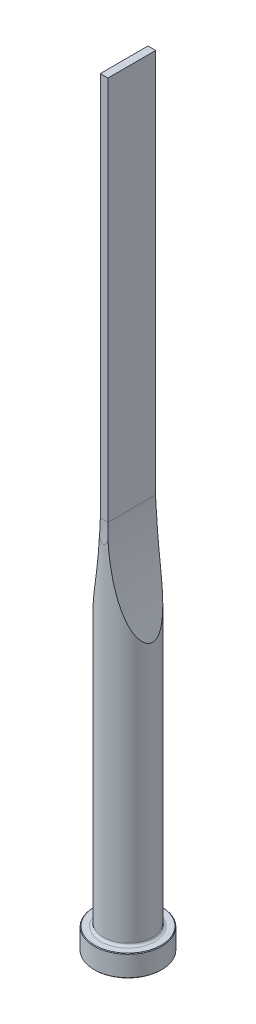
SolidWorks part; units mm, degrees
ref_plane "Front Plane" through (0, 0, 0) normal (0, 0, 1) x (1, 0, 0)
ref_plane "Top Plane" through (0, 0, 0) normal (0, 1, 0) x (1, 0, 0)
ref_plane "Right Plane" through (0, 0, 0) normal (1, 0, 0) x (0, 0, -1)
sketch "Sketch1" plane through (0, 0, 0) normal (0, 0, 1) x (1, 0, 0)
  line L0 (0, 0) -> (10.8, 0)
  line L1 (55, 0) -> (-55, 0) construction
  line L2 (11, 0.2) -> (11, 6.8)
  line L3 (10.8, 7) -> (8.8, 7)
  line L4 (8, 7.8) -> (8, 250)
  line L5 (0, 250) -> (8, 250)
  line L6 (11, 6.8) -> (10.8, 7)
  line L7 (10.8, 0) -> (11, 0.2)
  line L8 (0, 250) -> (0, 0)
  arc A0 (8, 7.8) -> (8.8, 7) centre (8.8, 7.8) ccw
  point P1 (11, 0)
  point P6 (11, 7)
  dimension "D4" = 0.8
  dimension "D1" = 8
  dimension "D2" = 11
  dimension "D3" = 7
  dimension "D5" = 250
revolve "Revolve1" add sketch "Sketch1" angle 360 about L8
sketch "Sketch2" plane through (0, 0, 0) normal (0, 0, 1) x (1, 0, 0)
  line L0 (1.25, 250) -> (1.25, 125)
  line L1 (8, 250) -> (-8, 250) construction
  line L2 (-1.25, 250) -> (-1.25, 125)
  line L3 (8, 250) -> (8, 90.803)
  line L4 (-8, 250) -> (-8, 90.803)
  line L5 (0, -12.1) -> (0, 12.1) construction
  line L6 (8, 250) -> (1.25, 250)
  line L8 (-1.25, 250) -> (-8, 250)
  arc A0 (1.25, 125) -> (8, 90.803) centre (91.25, 125) ccw
  arc A1 (-1.25, 125) -> (-8, 90.803) centre (-91.25, 125) cw
  dimension "D4" = 90
  dimension "D1" = 125
  dimension "D2" = 2.5
  dimension "D3" = 1.25
extrude "Cut-Extrude1" cut sketch "Sketch2" against normal mid plane 20
sketch "Sketch3" plane through (0, 0, 0) normal (1, 0, 0) x (0, 0, -1)
  line L0 (7.75, 250) -> (7.75, 125)
  line L1 (-7.9017, 250) -> (7.9017, 250) construction
  line L2 (-7.75, 250) -> (-7.75, 125)
  line L3 (8, 250) -> (8, 118.2965)
  line L4 (7.75, 250) -> (8, 250)
  line L5 (0, 12.1) -> (0, -12.1) construction
  line L6 (-8, 250) -> (-8, 118.2965)
  line L8 (-7.75, 250) -> (-8, 250)
  arc A0 (7.75, 125) -> (8, 118.2965) centre (97.75, 125) ccw
  arc A1 (-7.75, 125) -> (-8, 118.2965) centre (-97.75, 125) cw
  dimension "D2" = 90
  dimension "D1" = 125
  dimension "D3" = 15.5
  dimension "D4" = 7.75
extrude "Cut-Extrude2" cut sketch "Sketch3" against normal mid plane 20
